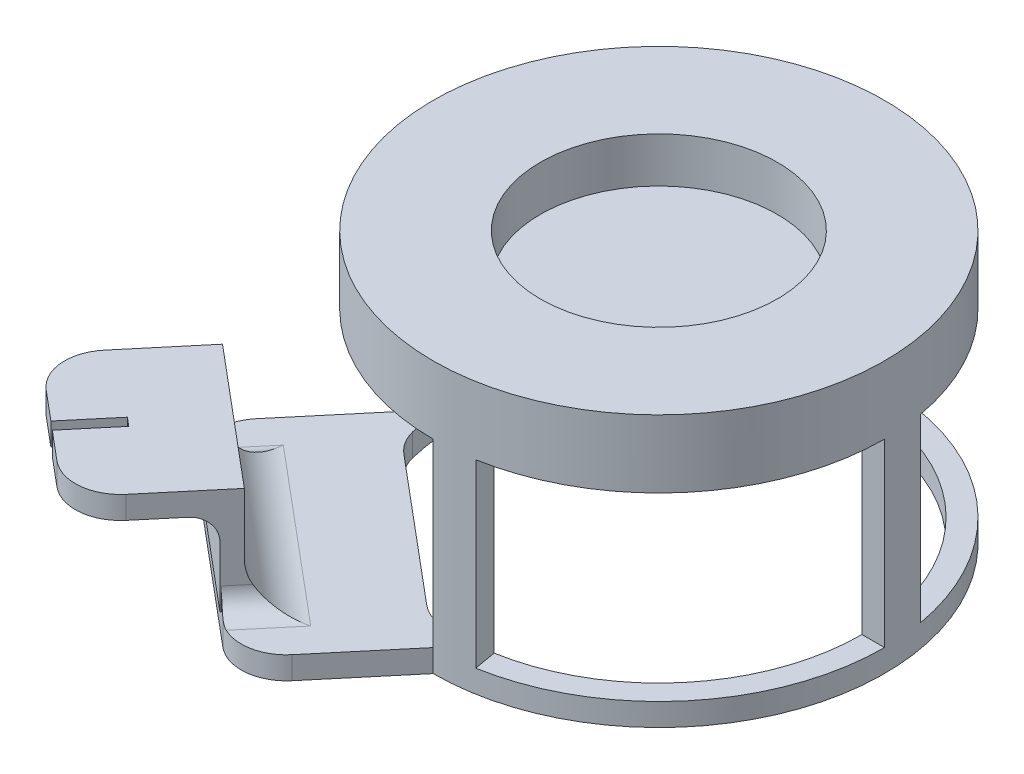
SolidWorks part; units mm, degrees
ref_plane "Front Plane" through (0, 0, 0) normal (0, 0, 1) x (1, 0, 0)
ref_plane "Top Plane" through (0, 0, 0) normal (0, 1, 0) x (1, 0, 0)
ref_plane "Right Plane" through (0, 0, 0) normal (1, 0, 0) x (0, 0, -1)
sketch "Sketch1" plane through (0, 0, 0) normal (0, 1, 0) x (1, 0, 0)
  circle A0 centre (0, 0) radius 25.4
  dimension "D1" = 50.8
extrude "Boss-Extrude1" add sketch "Sketch1" along normal blind 7.62
sketch "Sketch2" plane through (0, 7.62, 0) normal (0, 1, 0) x (1, 0, 0)
  circle A0 centre (0, 0) radius 13.335
  dimension "D1" = 26.67
extrude "Cut-Extrude1" cut sketch "Sketch2" against normal blind 5.08
sketch "Sketch3" plane through (0, 0, 0) normal (0, -1, 0) x (1, 0, 0)
  circle A0 centre (0, 0) radius 25.4
extrude "Boss-Extrude2" add sketch "Sketch3" along normal blind 22.86
sketch "Sketch4" plane through (0, -22.86, 0) normal (0, -1, 0) x (1, 0, 0)
  circle A2 centre (0, 0) radius 22.86
  circle A3 centre (0, 0) radius 22.86
  dimension "D1" = 2.54
extrude "Cut-Extrude2" cut sketch "Sketch4" against normal blind 22.86
sketch "Sketch5" plane through (0, 0, 0) normal (0, 0, 1) x (1, 0, 0)
  line L0 (-22.86, -22.86) -> (22.86, -22.86) construction
  line L1 (0, 0) -> (58.5728, 0)
  line L2 (0, 0) -> (0, -20.32)
  line L3 (0, -20.32) -> (58.5728, -20.32)
  line L4 (58.5728, 0) -> (58.5728, -20.32)
  dimension "D1" = 2.54
revolve "Cut-Revolve1" cut sketch "Sketch5" angle 80 about L2
pattern_circular "CirPattern4" count 4 over 360 about axis through (0, 7.62, 0) along (0, -1, 0) of "Cut-Revolve1"
shell "Shell1" thickness 2.54
sketch "Sketch9" plane through (0, -20.32, 0) normal (0, 1, 0) x (1, 0, 0)
  line L0 (-25.0141, -4.4107) -> (0, -25.4)
  line L1 (-25.0141, -4.4107) -> (-35.5279, -16.9404)
  line L2 (0, -25.4) -> (-10.5137, -37.9298)
  line L3 (-35.5279, -16.9404) -> (-10.5137, -37.9298)
  arc A1 (-25.0141, -4.4107) -> (0, -25.4) centre (0, 0) ccw construction
  dimension "D1" = 35.814
extrude "Boss-Extrude4" add sketch "Sketch9" against normal blind 2.54
sketch "Sketch12" plane through (0, -20.32, 0) normal (0, 1, 0) x (1, 0, 0)
  line L0 (-20.1497, -8.4924) -> (-4.8644, -21.3183)
  line L1 (-20.1497, -8.4924) -> (-38.8269, -30.7509)
  line L2 (-4.8644, -21.3183) -> (-23.5415, -43.5768)
  line L3 (-38.8269, -30.7509) -> (-23.5415, -43.5768)
  line L4 (-3.315, -22.6184) -> (-21.6991, -7.1923) construction
  line L5 (-10.5137, -37.9298) -> (0, -25.4) construction
  line L7 (-25.0141, -4.4107) -> (-35.5279, -16.9404) construction
  line L8 (-35.5279, -16.9404) -> (-10.5137, -37.9298) construction
  dimension "D1" = 6.35
  dimension "D2" = 6.35
  dimension "D3" = 12.7
extrude "Boss-Extrude5" add sketch "Sketch12" along normal blind 11.938
sketch "Sketch13" plane through (0, -20.32, 0) normal (0, -1, 0) x (1, 0, 0)
  line L0 (-38.8269, 30.7509) -> (-23.5415, 43.5768)
  line L1 (-38.8269, 30.7509) -> (-30.7407, 21.1142)
  line L2 (-23.5415, 43.5768) -> (-15.4553, 33.9401)
  line L3 (-30.7407, 21.1142) -> (-15.4553, 33.9401)
extrude "Cut-Extrude3" cut sketch "Sketch13" against normal blind 9.398
sketch "Sketch14" plane through (0, -8.382, 0) normal (0, 1, 0) x (1, 0, 0)
  line L1 (-35.8892, -41.8186) -> (-27.7258, -32.0898)
  line L2 (-35.8892, -41.8186) -> (-34.9164, -42.6349)
  line L3 (-27.7258, -32.0898) -> (-26.753, -32.9062)
  line L4 (-34.9164, -42.6349) -> (-26.753, -32.9062)
  line L5 (-35.8892, -41.8186) -> (-26.753, -32.9062) construction
  line L6 (-27.7258, -32.0898) -> (-34.9164, -42.6349) construction
  point P4 (-31.3211, -37.3624)
  dimension "D1" = 1.27
  dimension "D2" = 12.7
extrude "Cut-Extrude4" cut sketch "Sketch14" against normal blind 10.668
shell "Shell2" thickness 2.54
sketch "Sketch15" plane through (-14.1397, 0, 16.8511) normal (-0.6428, 0, 0.766) x (0.766, 0, 0.6428)
  line L0 (7.4368, -20.32) -> (7.4368, -8.382)
  line L1 (7.4368, -20.32) -> (-7.3169, -20.32)
  line L2 (7.4368, -8.382) -> (-7.3169, -8.382)
  line L3 (-7.3169, -20.32) -> (-7.3169, -8.382)
extrude "Cut-Extrude5" cut sketch "Sketch15" against normal blind 10.668
sketch "Sketch20" plane through (0, -8.382, 0) normal (0, 1, 0) x (1, 0, 0)
  line L0 (-14.203, -32.4476) -> (-4.8644, -21.3183)
  line L1 (-14.203, -32.4476) -> (-29.4935, -19.6173)
  line L2 (-4.8644, -21.3183) -> (-20.1549, -8.488)
  line L3 (-29.4935, -19.6173) -> (-20.1549, -8.488)
  line L4 (-23.5415, -43.5768) -> (-4.8644, -21.3183) construction
extrude "Cut-Extrude7" cut sketch "Sketch20" against normal blind 11.938
fillet "Fillet1" radius 2.54 1 edges at (-14.7905, -20.32, 33.1478)
fillet "Fillet2" radius 2.54 1 edges at (-30.0759, -20.32, 20.3219)
fillet "Fillet3" radius 5.08 1 edges at (-21.8456, -20.32, 26.0346)
fillet "Fillet4" radius 2.54 1 edges at (-23.098, -10.922, 27.5271)
fillet "Fillet5" radius 5.08 1 edges at (-38.8269, -9.652, 30.7509)
fillet "Fillet6" radius 5.08 1 edges at (-23.5415, -9.652, 43.5768)
fillet "Fillet7" radius 5.08 1 edges at (-3.315, -21.59, 22.6184)
fillet "Fillet8" radius 5.08 1 edges at (-21.6991, -21.59, 7.1923)
fillet "Fillet9" radius 5.08 1 edges at (-35.5279, -21.59, 16.9404)
fillet "Fillet10" radius 5.08 1 edges at (-10.5137, -21.59, 37.9298)
